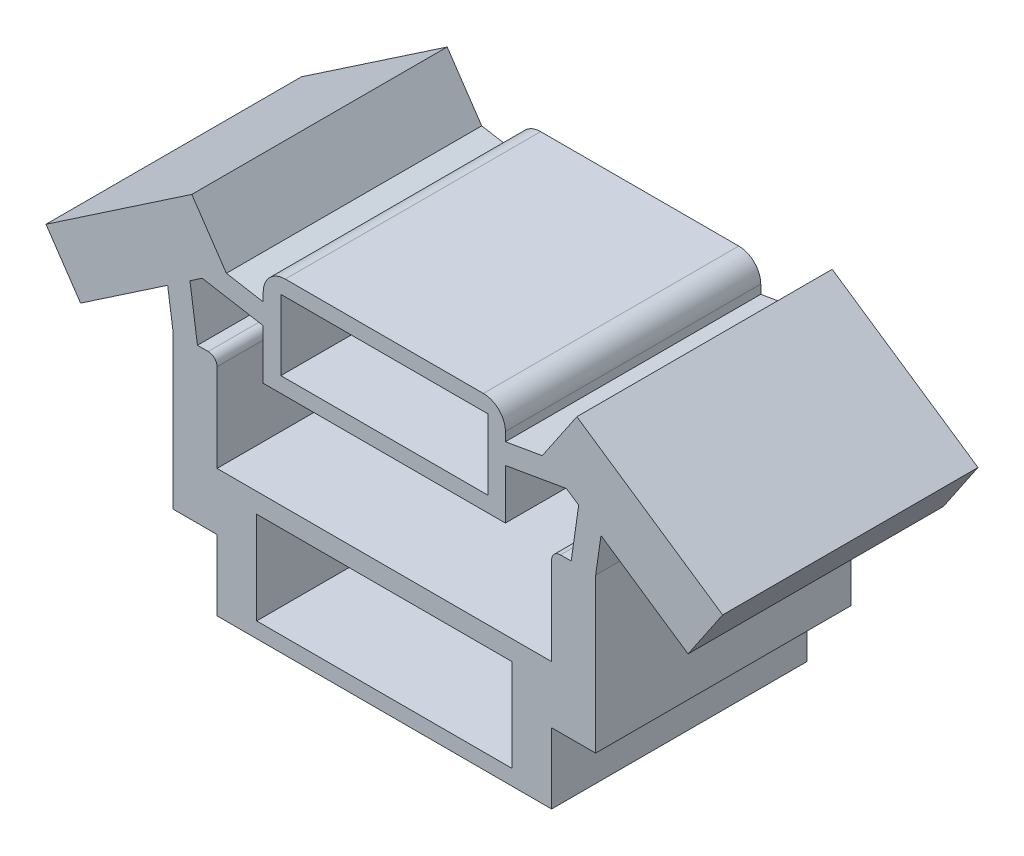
SolidWorks part; units mm, degrees
ref_plane "前视基准面" through (0, 0, 0) normal (0, 0, 1) x (1, 0, 0)
ref_plane "上视基准面" through (0, 0, 0) normal (0, 1, 0) x (1, 0, 0)
ref_plane "右视基准面" through (0, 0, 0) normal (1, 0, 0) x (0, 0, -1)
other "Configuration Table"
sketch "草图1" plane through (0, 0, 0) normal (0, 0, 1) x (1, 0, 0)
  line L0 (2.75, 5.2) -> (3.5876, 5.3447)
  line L1 (-3.8, -1.4) -> (3.8, -1.4)
  line L2 (-3.8, -1.4) -> (-3.8, 1.4)
  line L4 (3.8, -1.4) -> (3.8, 0.1)
  line L5 (-3.8, -1.4) -> (3.8, 1.4) construction
  line L6 (-3.8, 1.4) -> (3.8, -1.4) construction
  line L7 (-2.75, 5.2) -> (2.75, 5.2)
  line L8 (-2.75, 5.2) -> (-2.75, 3.6)
  line L9 (-2.75, 3.6) -> (2.75, 3.6)
  line L10 (2.75, 4.7332) -> (2.75, 3.6)
  line L11 (-2.75, 5.2) -> (2.75, 3.6) construction
  line L12 (-2.75, 3.6) -> (2.75, 5.2) construction
  line L14 (3.8, 0.1) -> (4.8, 0.1)
  line L17 (4.3727, 6.5038) -> (3.5876, 5.3447)
  line L19 (4.3727, 6.5038) -> (7.6845, 4.2605)
  line L33 (2.75, 5.2) -> (2.75, 4.7332) construction
  line L34 (3.5876, 5.3447) -> (4.1367, 4.9727) construction
  line L37 (4.8, 3.6) -> (4.8, 0.1)
  line L38 (-3.8, 1.4) -> (3.8, 1.4)
  line L39 (3.8, 1.4) -> (3.8, 0.1) construction
  line L40 (0, 9.062) -> (0, -4.0269) construction
  line L41 (2.75, 4.7332) -> (4.1367, 4.9727)
  line L48 (4.1367, 4.9727) -> (4.415, 4.7842)
  line L51 (4.2443, 3.6) -> (4.415, 4.7842)
  line L53 (4.9212, 4.4413) -> (6.8993, 3.1014)
  line L55 (4.415, 4.7842) -> (4.9212, 4.4413) construction
  line L56 (4.2443, 3.6) -> (4.8, 3.6) construction
  line L57 (3.8, 1.4) -> (3.8, 3.6)
  line L58 (3.8, 3.6) -> (4.2443, 3.6)
  line L59 (4.8, 3.6) -> (4.9212, 4.4413)
  line L60 (6.8993, 3.1014) -> (7.6845, 4.2605)
  point P0 (0, 0)
  point P6 (0, 4.4)
  dimension "D1" = 7.6
  dimension "D2" = 2.8
  dimension "D3" = 5.5
  dimension "D4" = 1.6
  dimension "D5" = 1
  dimension "D6" = 81.8
  dimension "D7" = 0.85
  dimension "D8" = 0.46
  dimension "D9" = 3.5
  dimension "D10" = 1.4
  dimension "D11" = 0.55
  dimension "D12" = 2.2
  dimension "D13" = 0.85
  dimension "D14" = 2.2
  dimension "D15" = 4
  dimension "D16" = 99.8
extrude "凸台-拉伸1" add sketch "草图1" along normal blind 5.8
mirror "镜向1" about plane through (0, 0, 0) normal (1, 0, 0) of "凸台-拉伸1"
sketch "草图10" plane through (0, 0, 5.8) normal (0, 0, 1) x (1, 0, 0)
  line L0 (-2.75, 3.6) -> (2.75, 3.6) construction
  line L1 (-2.9, -1.05) -> (2.9, -1.05)
  line L2 (-2.9, -1.05) -> (-2.9, 1.05)
  line L3 (-2.9, 1.05) -> (2.9, 1.05)
  line L4 (2.9, -1.05) -> (2.9, 1.05)
  line L5 (-2.9, -1.05) -> (2.9, 1.05) construction
  line L6 (-2.9, 1.05) -> (2.9, -1.05) construction
  line L7 (-2.35, 5.55) -> (2.35, 5.55)
  line L8 (-2.35, 5.55) -> (-2.35, 3.95)
  line L9 (-2.35, 3.95) -> (2.35, 3.95)
  line L10 (2.35, 5.55) -> (2.35, 3.95)
  point P0 (0, 0)
  point P10 (0, 5.55)
  dimension "D1" = 5.8
  dimension "D2" = 2.1
  dimension "D3" = 4.7
  dimension "D4" = 1.6
  dimension "D5" = 0.35
extrude "切除-拉伸3" cut sketch "草图10" against normal through all
sketch "草图11" plane through (0, 0, 5.8) normal (0, 0, 1) x (1, 0, 0)
  line L0 (-2.35, 5.2) -> (-2.75, 5.2)
  line L1 (-2.75, 5.2) -> (-2.75, 5.9)
  line L2 (-2.75, 5.9) -> (2.75, 5.9)
  line L3 (2.75, 5.9) -> (2.75, 5.2)
  line L4 (2.75, 3.6) -> (2.75, 4.7332) construction
  line L5 (2.75, 5.2) -> (2.35, 5.2)
  line L6 (2.35, 5.2) -> (2.35, 5.55)
  line L7 (2.35, 5.55) -> (-2.35, 5.55)
  line L8 (-2.35, 5.55) -> (-2.35, 5.2)
  line L9 (-2.35, 3.95) -> (2.35, 3.95) construction
  dimension "D1" = 0.35
  dimension "D2" = 1.6
extrude "凸台-拉伸2" add sketch "草图11" against normal up to surface (5.8 mm away)
fillet "圆角1" radius 0.5 2 edges at (-2.75, 5.9, 2.9) (2.75, 5.9, 2.9)
sketch "草图12" plane through (0, 0, 5.8) normal (0, 0, 1) x (1, 0, 0)
  line L0 (-2.9, 1.05) -> (-2.9, -1.05) construction
  line L1 (-2.9, 0.95) -> (2.9, 0.95)
  line L2 (-2.9, 0.95) -> (-2.9, 1.05)
  line L3 (-2.9, 1.05) -> (2.9, 1.05)
  line L4 (2.9, 0.95) -> (2.9, 1.05)
  line L5 (3.8, -1.4) -> (3.8, 0.1) construction
  line L6 (-3.8, -1.4) -> (3.8, -1.4)
  line L7 (-3.8, -1.4) -> (-3.8, -1.5)
  line L8 (-3.8, -1.5) -> (3.8, -1.5)
  line L9 (3.8, -1.4) -> (3.8, -1.5)
  dimension "D1" = 0.1
  dimension "D2" = 0.1
extrude "凸台-拉伸3" add sketch "草图12" against normal up to surface (5.8 mm away)
sketch "草图14" plane through (0, 0, 5.8) normal (0, 0, 1) x (1, 0, 0)
  line L0 (2.9, -1.05) -> (2.9, 0.95) construction
  line L1 (-2.9, -1.05) -> (2.9, -1.05)
  line L2 (-2.9, -1.05) -> (-2.9, -1.15)
  line L3 (-2.9, -1.15) -> (2.9, -1.15)
  line L4 (2.9, -1.05) -> (2.9, -1.15)
  dimension "D1" = 0.1
extrude "切除-拉伸4" cut sketch "草图14" against normal through all
sketch "草图16" plane through (0, 0, 5.8) normal (0, 0, 1) x (1, 0, 0)
  line L0 (-2.35, 5.55) -> (-2.35, 3.95) construction
  line L1 (-2.35, 4.05) -> (2.35, 4.05)
  line L2 (-2.35, 4.05) -> (-2.35, 3.95)
  line L3 (-2.35, 3.95) -> (2.35, 3.95)
  line L4 (2.35, 4.05) -> (2.35, 3.95)
  dimension "D1" = 0.1
extrude "凸台-拉伸4" [suppressed] add sketch "草图16" against normal up to surface (5.8 mm away)
fillet "圆角2" radius 0.2 2 edges at (-3.8, 3.6, 2.9) (3.8, 3.6, 2.9)
